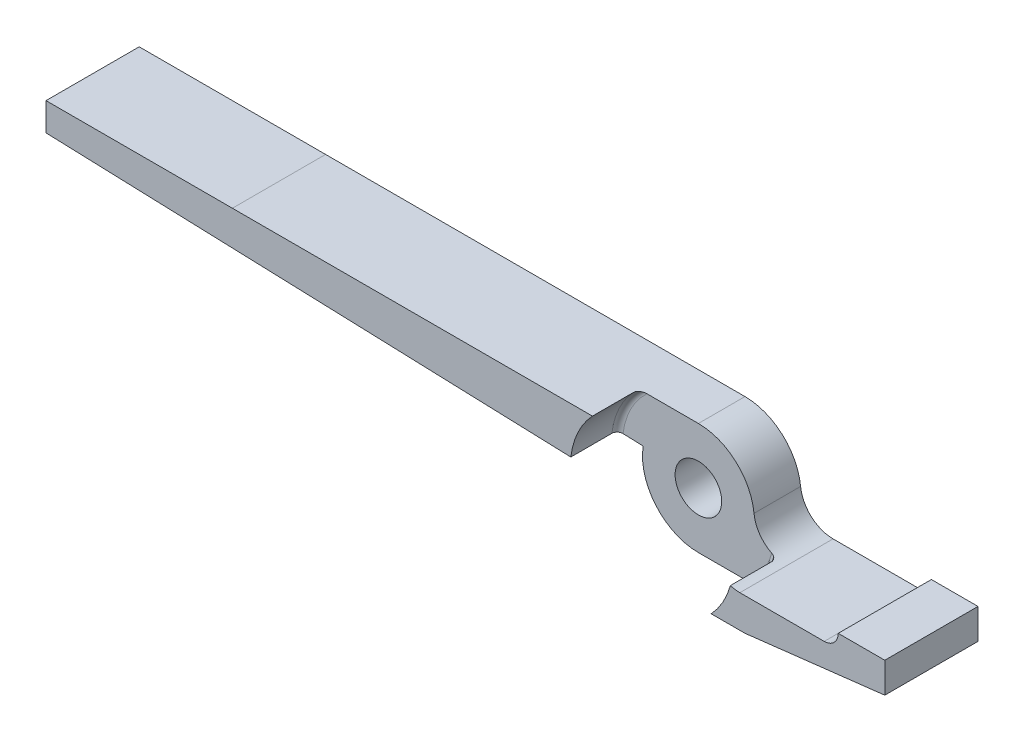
SolidWorks part; units mm, degrees
ref_plane "Front" through (0, 0, 0) normal (0, 0, 1) x (1, 0, 0)
ref_plane "Top" through (0, 0, 0) normal (0, 1, 0) x (1, 0, 0)
ref_plane "Right" through (0, 0, 0) normal (1, 0, 0) x (0, 0, -1)
sketch "Sketch1" plane through (0, 0, 0) normal (0, 0, 1) x (1, 0, 0)
  line L1 (93.4161, 0) -> (-95.7221, 0) construction
  line L2 (0, 71.2877) -> (0, -65.354) construction
  line L3 (23.9959, -6.35) -> (63.5, -6.35)
  line L4 (63.5, -6.35) -> (63.5, -15.24)
  line L6 (-165.1, 15.24) -> (0, 15.24)
  line L8 (-165.1, 7.62) -> (-15.053, 2.3802)
  line L9 (0, 0) -> (0, 19.3148) construction
  line L26 (0, -15.24) -> (63.5, -15.24)
  line L29 (-165.1, 7.62) -> (-165.1, 15.24)
  arc A0 (-15.053, 2.3802) -> (0, -15.24) centre (0, 0) ccw
  arc A1 (15.1553, 1.6042) -> (0, 15.24) centre (0, 0) ccw
  arc A3 (15.1553, 1.6042) -> (23.9959, -6.35) centre (23.9959, 2.54) ccw
  dimension "D1" = 2
  dimension "D4" = 15.24
  dimension "D6" = 63.5
  dimension "D5" = 17.78
  dimension "D2" = 12.7
  dimension "D7" = 165.1
  dimension "D8" = 7.62
extrude "Extrude1" add sketch "Sketch1" along normal blind 25.4
sketch "Sketch17" plane through (0, 0, 0) normal (0, 0, -1) x (-1, 0, 0)
  line L0 (-63.5, -10.795) -> (-25.4, -15.24)
  line L1 (-63.5, -15.24) -> (-63.5, -6.35) construction
  line L2 (0, -15.24) -> (-63.5, -15.24) construction
  line L3 (-63.5, -15.24) -> (-63.5, -10.795)
  line L4 (-25.4, -15.24) -> (-63.5, -15.24)
  dimension "D1" = 38.1
extrude "Cut-Extrude7" cut sketch "Sketch17" against normal through all
sketch "Sketch7" plane through (0, 0, 25.4) normal (0, 0, 1) x (1, 0, 0)
  circle A0 centre (0, 0) radius 6.35
  arc A2 (-15.053, 2.3802) -> (0, -15.24) centre (0, 0) ccw construction
  dimension "D1" = 12.7
extrude "Cut-Extrude6" cut sketch "Sketch7" against normal through all
sketch "Sketch19" plane through (0, 0, 25.4) normal (0, 0, 1) x (1, 0, 0)
  circle A0 centre (0, 0) radius 22.225
  circle A1 centre (0, 0) radius 6.35 construction
  dimension "D1" = 44.45
extrude "Cut-Extrude8" cut sketch "Sketch19" against normal blind 12.7
fillet "Fillet28" radius 1.524 2 edges at (19.3569, -10.9207, 12.7) (-20.1365, 9.406, 12.7)
sketch "Sketch20" plane through (0, -6.35, 0) normal (0, 1, 0) x (-1, 0, 0)
  line L0 (-50.8, 25.4) -> (-50.8, 0)
  line L4 (-63.5, 0) -> (-23.9959, 0)
  line L5 (-23.9959, 0) -> (-23.9959, 25.4)
  line L6 (-23.9959, 25.4) -> (-63.5, 25.4)
  line L7 (-63.5, 25.4) -> (-63.5, 0)
  line L8 (-63.5, 0) -> (-50.8, 0)
  line L10 (-50.8, 25.4) -> (-63.5, 25.4)
  line L11 (-63.5, 25.4) -> (-63.5, 0)
  dimension "D2" = 12.7
  dimension "D1" = 0
extrude "Extrude5" add sketch "Sketch20" along normal blind 3.81
fillet "Fillet29" radius 3.81 1 edges at (50.8, -6.35, 12.7)
sketch "Sketch21" plane through (0, 15.24, 0) normal (0, 1, 0) x (-1, 0, 0)
  line L0 (114.3, 25.4) -> (114.3, 0)
  line L1 (16.1769, 25.4) -> (165.1, 25.4) construction
  line L2 (0, 0) -> (165.1, 0) construction
  line L3 (165.1, 25.4) -> (165.1, 0) construction
  dimension "D1" = 50.8
sketch "Sketch22" plane through (0.0647, 1.8523, 0) normal (-0.0349, -0.9994, 0) x (0.9994, -0.0349, 0)
  line L0 (-160.1854, 0) -> (-160.1854, 25.4)
  line L1 (-165.2654, 0) -> (-15.1269, 0) construction
  line L2 (-165.2654, 25.4) -> (-22.1476, 25.4) construction
  line L3 (-165.2654, 25.4) -> (-165.2654, 0) construction
  dimension "D1" = 5.08
